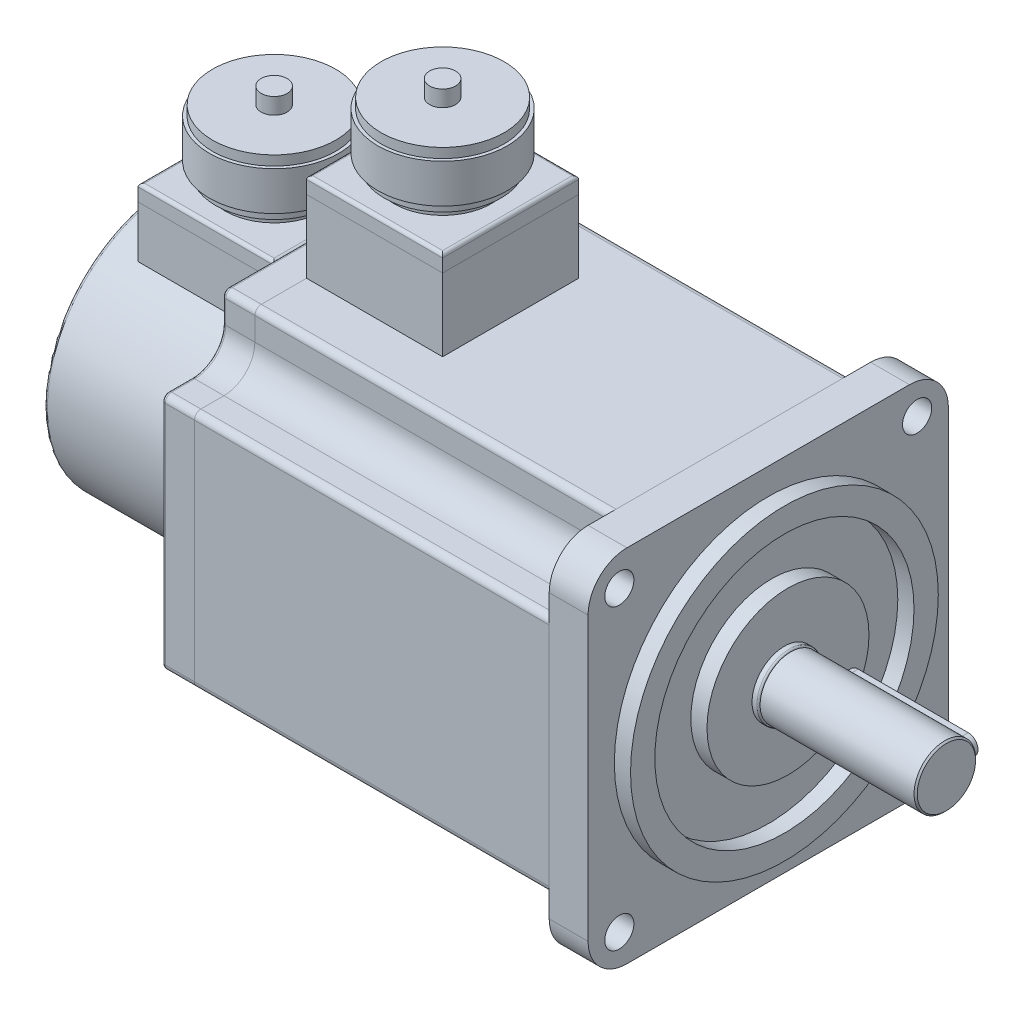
SolidWorks part; units mm, degrees
ref_plane "前视基准面" through (0, 0, 0) normal (0, 0, 1) x (1, 0, 0)
ref_plane "上视基准面" through (0, 0, 0) normal (0, 1, 0) x (1, 0, 0)
ref_plane "右视基准面" through (0, 0, 0) normal (1, 0, 0) x (0, 0, -1)
sketch "草图1" plane through (0, 0, 0) normal (1, 0, 0) x (0, 0, -1)
  line L1 (-43.6, -55.6) -> (43.6, -55.6)
  line L2 (-55.6, -43.6) -> (-55.6, 43.6)
  line L3 (-43.6, 55.6) -> (43.6, 55.6)
  line L4 (55.6, -43.6) -> (55.6, 43.6)
  line L5 (-55.6, -55.6) -> (55.6, 55.6) construction
  line L6 (-55.6, 55.6) -> (55.6, -55.6) construction
  arc A0 (-43.6, -55.6) -> (-55.6, -43.6) centre (-43.6, -43.6) cw
  arc A1 (43.6, -55.6) -> (55.6, -43.6) centre (43.6, -43.6) ccw
  arc A2 (43.6, 55.6) -> (55.6, 43.6) centre (43.6, 43.6) cw
  arc A3 (-55.6, 43.6) -> (-43.6, 55.6) centre (-43.6, 43.6) cw
  point P0 (0, 0)
  dimension "D1" = 12
extrude "凸台-拉伸1" add sketch "草图1" along normal blind 10
sketch "草图2" plane through (10, 0, 0) normal (1, 0, 0) x (0, 0, -1)
  line L0 (43.6, 55.6) -> (-43.6, 55.6) construction
  line L1 (-43.6, -55.6) -> (43.6, -55.6)
  line L2 (-55.6, -43.6) -> (-55.6, 43.6)
  line L3 (-43.6, 55.6) -> (43.6, 55.6)
  line L4 (55.6, -43.6) -> (55.6, 43.6)
  line L5 (-55.6, -55.6) -> (55.6, 55.6) construction
  line L6 (-55.6, 55.6) -> (55.6, -55.6) construction
  arc A0 (43.6, 55.6) -> (55.6, 43.6) centre (43.6, 43.6) cw
  arc A1 (43.6, -55.6) -> (55.6, -43.6) centre (43.6, -43.6) ccw
  arc A2 (-43.6, -55.6) -> (-55.6, -43.6) centre (-43.6, -43.6) cw
  arc A3 (-55.6, 43.6) -> (-43.6, 55.6) centre (-43.6, 43.6) cw
  point P0 (0, 0)
  dimension "D1" = 12
extrude "凸台-拉伸2" add sketch "草图2" along normal blind 109.5 separate body
sketch "草图3" plane through (119.5, 0, 0) normal (1, 0, 0) x (0, 0, -1)
  line L0 (43.6, 55.6) -> (-43.6, 55.6) construction
  line L1 (-43.6, -55.6) -> (43.6, -55.6)
  line L2 (-55.6, -43.6) -> (-55.6, 43.6)
  line L3 (-43.6, 55.6) -> (43.6, 55.6)
  line L4 (55.6, -43.6) -> (55.6, 43.6)
  line L5 (-55.6, -55.6) -> (55.6, 55.6) construction
  line L6 (-55.6, 55.6) -> (55.6, -55.6) construction
  arc A0 (43.6, 55.6) -> (55.6, 43.6) centre (43.6, 43.6) cw
  arc A1 (43.6, -55.6) -> (55.6, -43.6) centre (43.6, -43.6) ccw
  arc A2 (-43.6, -55.6) -> (-55.6, -43.6) centre (-43.6, -43.6) cw
  arc A3 (-55.6, 43.6) -> (-43.6, 55.6) centre (-43.6, 43.6) cw
  point P0 (0, 0)
  dimension "D1" = 12
extrude "凸台-拉伸3" add sketch "草图3" along normal blind 12 separate body
sketch "草图6" plane through (0, 0, 0) normal (-1, 0, 0) x (0, 0, 1)
  line L0 (-46.5, 36.9491) -> (-53.6, 36.9491)
  line L1 (-55.6, 34.9491) -> (-55.6, 43.6)
  line L3 (-43.6, 55.6) -> (-34.9491, 55.6)
  line L4 (34.9491, 55.6) -> (43.6, 55.6)
  line L6 (55.6, 43.6) -> (55.6, 34.9491)
  line L7 (-55.6, -43.6) -> (-55.6, 43.6) construction
  line L9 (-53.6, -36.9491) -> (-46.5, -36.9491)
  line L10 (55.6, -34.9491) -> (55.6, -43.6)
  line L11 (-36.9491, -46.5) -> (-36.9491, -53.6)
  line L12 (43.6, -55.6) -> (-43.6, -55.6) construction
  line L14 (36.9491, -53.6) -> (36.9491, -46.5)
  line L16 (46.5, -36.9491) -> (53.6, -36.9491)
  line L17 (55.6, 43.6) -> (55.6, -43.6) construction
  line L19 (53.6, 36.9491) -> (46.5, 36.9491)
  line L20 (43.6, -55.6) -> (34.9491, -55.6)
  line L21 (36.9491, 46.5) -> (36.9491, 53.6)
  line L24 (-43.6, 55.6) -> (43.6, 55.6) construction
  line L25 (-36.9491, 53.6) -> (-36.9491, 46.5)
  line L26 (-34.9491, -55.6) -> (-43.6, -55.6)
  line L28 (-55.6, -43.6) -> (-55.6, -34.9491)
  arc A0 (-46.5, 36.9491) -> (-36.9491, 46.5) centre (-46.5, 46.5) ccw
  arc A1 (36.9491, 46.5) -> (46.5, 36.9491) centre (46.5, 46.5) ccw
  arc A2 (-36.9491, -46.5) -> (-46.5, -36.9491) centre (-46.5, -46.5) ccw
  arc A3 (46.5, -36.9491) -> (36.9491, -46.5) centre (46.5, -46.5) ccw
  arc A4 (-34.9491, 55.6) -> (-36.9491, 53.6) centre (-34.9491, 53.6) ccw
  arc A5 (36.9491, 53.6) -> (34.9491, 55.6) centre (34.9491, 53.6) ccw
  arc A6 (55.6, 34.9491) -> (53.6, 36.9491) centre (53.6, 34.9491) ccw
  arc A7 (53.6, -36.9491) -> (55.6, -34.9491) centre (53.6, -34.9491) ccw
  arc A8 (34.9491, -55.6) -> (36.9491, -53.6) centre (34.9491, -53.6) ccw
  arc A9 (-36.9491, -53.6) -> (-34.9491, -55.6) centre (-34.9491, -53.6) ccw
  arc A10 (-55.6, -34.9491) -> (-53.6, -36.9491) centre (-53.6, -34.9491) ccw
  arc A11 (-53.6, 36.9491) -> (-55.6, 34.9491) centre (-53.6, 34.9491) ccw
  arc A12 (-43.6, 55.6) -> (-55.6, 43.6) centre (-43.6, 43.6) ccw
  arc A13 (55.6, 43.6) -> (43.6, 55.6) centre (43.6, 43.6) ccw
  arc A14 (43.6, -55.6) -> (55.6, -43.6) centre (43.6, -43.6) ccw
  arc A15 (-55.6, -43.6) -> (-43.6, -55.6) centre (-43.6, -43.6) ccw
  point P0 (0, 0)
  point P10 (-36.9491, 55.6)
  point P41 (55.6, 36.9491)
  point P44 (55.6, -36.9491)
  point P47 (36.9491, -55.6)
  point P50 (-36.9491, -55.6)
  point P53 (-55.6, -36.9491)
  point P56 (-55.6, 36.9491)
  dimension "D1" = 2
extrude "切除-拉伸1" cut sketch "草图6" against normal blind 119.5
fillet "圆角1" radius 1 24 edges at (0, 55.6, 0) (0, 55.0142, 36.3633) (0, 50.05, 36.9491) (0, 39.7465, 39.7465) (0, 36.9491, 50.05) (0, 36.3633, 55.0142) (0, 0, 55.6) (0, -36.3633, 55.0142) (0, -36.9491, 50.05) (0, -39.7465, 39.7465) (0, -50.05, 36.9491) (0, -55.0142, 36.3633) (0, -55.6, 0) (0, -55.0142, -36.3633) (0, -50.05, -36.9491) (0, -39.7465, -39.7465) (0, -36.9491, -50.05) (0, -36.3633, -55.0142) (0, 0, -55.6) (0, 36.3633, -55.0142) (0, 36.9491, -50.05) (0, 39.7465, -39.7465) (0, 50.05, -36.9491) (0, 55.0142, -36.3633)
sketch "草图7" plane through (131.5, 0, 0) normal (1, 0, 0) x (0, 0, -1)
  circle A2 centre (-45.9619, 45.9619) radius 4.5
  circle A3 centre (45.9619, 45.9619) radius 4.5
  circle A4 centre (45.9619, -45.9619) radius 4.5
  circle A5 centre (-45.9619, -45.9619) radius 4.5
extrude "切除-拉伸2" cut sketch "草图7" against normal blind 12
sketch "草图8" plane through (131.5, 0, 0) normal (1, 0, 0) x (0, 0, -1)
  circle A0 centre (0, 0) radius 47.5
  circle A1 centre (0, 0) radius 40
  circle A2 centre (1.1033, 0) radius 25
extrude "凸台-拉伸4" add sketch "草图8" along normal blind 5 contours A0 A1 | A2
sketch "草图9" plane through (136.5, 0, 0) normal (1, 0, 0) x (0, 0, -1)
  circle A0 centre (0, 0) radius 10
extrude "凸台-拉伸5" add sketch "草图9" along normal blind 2 separate body
sketch "草图10" plane through (138.5, 0, 0) normal (1, 0, 0) x (0, 0, -1)
  circle A0 centre (0, 0) radius 9.5
extrude "凸台-拉伸6" add sketch "草图10" along normal blind 48 separate body
fillet "圆角2" radius 0.5 1 edges at (138.5, 0, -10)
ref_plane "基准面1" through (0, 0, -9.75) normal (0, 0, 1) x (1, 0, 0)
sketch "草图11" plane through (0, 0, -9.75) normal (0, 0, 1) x (1, 0, 0)
  line L4 (181, 3) -> (147, 3)
  line L6 (147, -3) -> (181, -3)
  arc A0 (181, -3) -> (181, 3) centre (181, 0) ccw
  arc A1 (147, 3) -> (147, -3) centre (147, 0) ccw
chamfer "倒角1" distance 0.5 angle 45 1 edges at (186.5, 0, -9.5)
sketch "草图13" plane through (0, 0, 0) normal (-1, 0, 0) x (0, 0, 1)
  circle A0 centre (0, 0) radius 40
extrude "凸台-拉伸8" add sketch "草图13" along normal blind 52 separate body
ref_plane "基准面2" through (0, 40, 0) normal (0, 1, 0) x (1, 0, 0)
sketch "草图14" plane through (0, 40, 0) normal (0, 1, 0) x (1, 0, 0)
  line L2 (-42, -21) -> (0, -21)
  line L3 (-42, -21) -> (-42, 21)
  line L4 (-42, 21) -> (0, 21)
  line L5 (0, -21) -> (0, 21)
  line L6 (-42, -21) -> (0, 21) construction
  line L7 (-42, 21) -> (0, -21) construction
extrude "切除-拉伸4" cut sketch "草图14" against normal blind 10
sketch "草图15" plane through (0, 30, 0) normal (0, 1, 0) x (1, 0, 0)
  line L1 (-42, -21) -> (0, -21)
  line L2 (-42, -21) -> (-42, 21)
  line L3 (-42, 21) -> (0, 21)
  line L4 (0, -21) -> (0, 21)
  line L5 (-42, -21) -> (0, 21) construction
  line L6 (-42, 21) -> (0, -21) construction
  point P0 (-21, 0)
extrude "凸台-拉伸9" add sketch "草图15" along normal blind 20
sketch "草图16" plane through (0, 50, 0) normal (0, 1, 0) x (1, 0, 0)
  line L0 (-42, 21) -> (0, 21) construction
  line L1 (-42, -21) -> (0, -21)
  line L2 (-42, -21) -> (-42, 21)
  line L3 (-42, 21) -> (0, 21)
  line L4 (0, -21) -> (0, 21)
  line L5 (-42, -21) -> (0, 21) construction
  line L6 (-42, 21) -> (0, -21) construction
  line L7 (0, 21) -> (-42, 21) construction
  point P0 (-21, 0)
extrude "凸台-拉伸10" add sketch "草图16" along normal blind 5 separate body
fillet "圆角3" radius 1 4 edges at (-21, 55, 21) (-42, 55, 0) (-21, 55, -21) (0, 55, 0)
sketch "草图17" plane through (0, 55, 0) normal (0, 1, 0) x (1, 0, 0)
  circle A0 centre (-21, 0) radius 15
extrude "凸台-拉伸11" add sketch "草图17" along normal blind 3 separate body
sketch "草图18" plane through (0, 58, 0) normal (0, 1, 0) x (1, 0, 0)
  circle A0 centre (-21, 0) radius 18
extrude "凸台-拉伸12" add sketch "草图18" along normal blind 3
sketch "草图19" plane through (0, 61, 0) normal (0, 1, 0) x (1, 0, 0)
  circle A0 centre (-21, 0) radius 20
extrude "凸台-拉伸13" add sketch "草图19" along normal blind 12
sketch "草图20" plane through (0, 73, 0) normal (0, 1, 0) x (1, 0, 0)
  circle A0 centre (-21, 0) radius 19
extrude "凸台-拉伸14" add sketch "草图20" along normal blind 3
sketch "草图21" plane through (0, 76, 0) normal (0, 1, 0) x (1, 0, 0)
  circle A0 centre (-21, 0) radius 4
extrude "凸台-拉伸15" add sketch "草图21" along normal blind 5
sketch "草图22" plane through (0, 55.6, 0) normal (0, 1, 0) x (1, 0, 0)
  line L3 (10, -21) -> (52, -21)
  line L4 (10, -21) -> (10, 21)
  line L5 (10, 21) -> (52, 21)
  line L6 (52, -21) -> (52, 21)
  line L7 (10, -21) -> (52, 21) construction
  line L8 (10, 21) -> (52, -21) construction
extrude "凸台-拉伸16" add sketch "草图22" along normal blind 22.4 separate body
sketch "草图23" plane through (0, 78, 0) normal (0, 1, 0) x (1, 0, 0)
  line L2 (52, 21) -> (10, 21) construction
  line L4 (10, -21) -> (52, -21)
  line L5 (10, -21) -> (10, 21)
  line L6 (10, 21) -> (52, 21)
  line L7 (52, -21) -> (52, 21)
  line L8 (10, -21) -> (52, 21) construction
  line L9 (10, 21) -> (52, -21) construction
  point P6 (31, 0)
extrude "凸台-拉伸17" add sketch "草图23" along normal blind 5 separate body
fillet "圆角4" radius 1 4 edges at (31, 83, 21) (10, 83, 0) (31, 83, -21) (52, 83, 0)
sketch "草图24" plane through (0, 83, 0) normal (0, 1, 0) x (1, 0, 0)
  circle A0 centre (31, 0) radius 15
extrude "凸台-拉伸18" add sketch "草图24" along normal blind 3 separate body
sketch "草图25" plane through (0, 86, 0) normal (0, 1, 0) x (1, 0, 0)
  circle A0 centre (31, 0) radius 18
extrude "凸台-拉伸19" add sketch "草图25" along normal blind 3 separate body
sketch "草图26" plane through (0, 89, 0) normal (0, 1, 0) x (1, 0, 0)
  circle A0 centre (31, 0) radius 20
extrude "凸台-拉伸20" add sketch "草图26" along normal blind 12 separate body
sketch "草图27" plane through (0, 101, 0) normal (0, 1, 0) x (1, 0, 0)
  circle A0 centre (31, 0) radius 19
extrude "凸台-拉伸21" add sketch "草图27" along normal blind 3 separate body
sketch "草图28" plane through (0, 104, 0) normal (0, 1, 0) x (1, 0, 0)
  circle A0 centre (31, 0) radius 4
extrude "凸台-拉伸22" add sketch "草图28" along normal blind 5 separate body
fillet "圆角5" radius 1 1 edges at (-52, 0, 40)
extrude "切除-拉伸5" cut sketch "草图11" along normal blind 3.5
sketch "草图32" plane through (0, 0, -6.25) normal (0, 0, -1) x (-1, 0, 0)
  line L0 (-181, 3) -> (-147, 3)
  line L2 (-147, -3) -> (-181, -3)
  arc A0 (-181, 3) -> (-181, -3) centre (-181, 0) ccw
  arc A1 (-147, -3) -> (-147, 3) centre (-147, 0) ccw
extrude "凸台-拉伸24" add sketch "草图32" along normal blind 6 separate body
